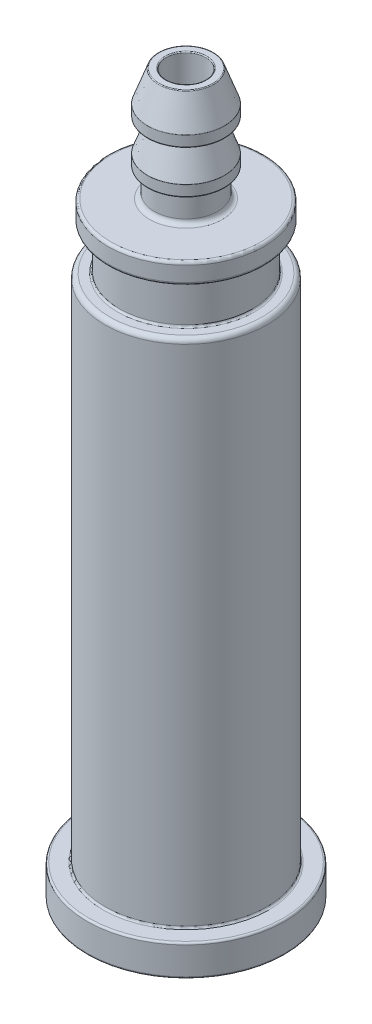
SolidWorks part; units mm, degrees
ref_plane "Plan de face" through (0, 0, 0) normal (0, 0, 1) x (1, 0, 0)
ref_plane "Plan de dessus" through (0, 0, 0) normal (0, 1, 0) x (1, 0, 0)
ref_plane "Plan de droite" through (0, 0, 0) normal (1, 0, 0) x (0, 0, -1)
sketch "Esquisse1" plane through (0, 0, 0) normal (0, 0, 1) x (1, 0, 0)
  line L0 (0, 0) -> (0, 72.1741) construction
  line L1 (7.625, 53.4) -> (7.625, 0.5)
  line L2 (8.675, 58.5) -> (8.675, 3.85)
  line L3 (7.625, 0.5) -> (8.75, 0.5)
  line L4 (8.75, 0.5) -> (9.35, 0)
  line L5 (9.35, 0) -> (9.65, 0)
  line L6 (9.65, 0) -> (10.25, 0.5)
  line L7 (10.25, 0.5) -> (10.6, 0.5)
  line L8 (10.6, 0.5) -> (10.6, 3.85)
  line L9 (10.6, 3.85) -> (8.675, 3.85)
  line L10 (8.675, 58.5) -> (7.1, 58.5)
  line L11 (7.1, 58.5) -> (7.1, 63.2)
  line L12 (7.1, 63.2) -> (8.35, 63.2)
  line L13 (8.35, 63.2) -> (8.35, 65.4)
  line L14 (8.35, 65.4) -> (3.4, 65.4)
  line L15 (3.4, 65.4) -> (3.4, 68.4)
  line L16 (3.4, 68.4) -> (4.125, 68.4)
  line L17 (4.125, 68.4) -> (4.125, 69.6)
  line L18 (4.125, 69.6) -> (3.0695, 72.5)
  line L19 (3.0695, 72.5) -> (3.0695, 73)
  line L20 (3.0695, 73) -> (4.125, 73)
  line L21 (4.125, 73) -> (4.125, 74.2)
  line L22 (4.125, 74.2) -> (2.9239, 77.5)
  line L23 (2.9239, 77.5) -> (2.125, 77.5)
  line L24 (2.125, 77.5) -> (2.125, 63.4)
  line L25 (4.5, 53.4) -> (7.625, 53.4)
  line L26 (4.5, 53.4) -> (4.5, 63.4)
  line L27 (4.5, 63.4) -> (2.125, 63.4)
  dimension "D1" = 15.25
  dimension "D2" = 17.35
  dimension "D3" = 17.5
  dimension "D4" = 0.5
  dimension "D5" = 20.5
  dimension "D6" = 0.3
  dimension "D7" = 0.6
  dimension "D8" = 3.85
  dimension "D9" = 58.5
  dimension "D10" = 14.2
  dimension "D11" = 4.7
  dimension "D12" = 16.7
  dimension "D13" = 2.2
  dimension "D14" = 6.8
  dimension "D15" = 4.25
  dimension "D16" = 8.25
  dimension "D17" = 8.25
  dimension "D18" = 12.1
  dimension "D19" = 4.5
  dimension "D20" = 1.2
  dimension "D21" = 1.2
  dimension "D22" = 3
  dimension "D23" = 0.5
  dimension "D24" = 160
  dimension "D25" = 160
  dimension "D26" = 63.4
  dimension "D27" = 10
  dimension "D28" = 9
  dimension "D29" = 10.6
revolve "Révolution1" add sketch "Esquisse1" angle 360 about L0
fillet "Congé1" radius 0.3 2 edges at (0, 63.2, -8.35) (0, 65.4, -8.35)
fillet "Congé2" radius 0.2 2 edges at (0, 58.5, -7.1) (0, 63.2, -7.1)
fillet "Congé3" radius 0.5 1 edges at (0, 58.5, -8.675)
fillet "Congé4" radius 0.5 1 edges at (0, 65.4, -3.4)
fillet "Congé5" radius 0.1 8 edges at (0, 73, -3.0695) (0, 68.4, -4.125) (0, 68.4, -3.4) (0, 69.6, -4.125) (0, 73, -4.125) (0, 74.2, -4.125) (0, 77.5, -2.9239) (0, 77.5, -2.125)
fillet "Congé6" radius 0.2 8 edges at (0, 0, -9.35) (0, 0, -9.65) (0, 0.5, -7.625) (0, 0.5, -8.75) (0, 0.5, -10.25) (0, 0.5, -10.6) (0, 3.85, -10.6) (0, 3.85, -8.675)
